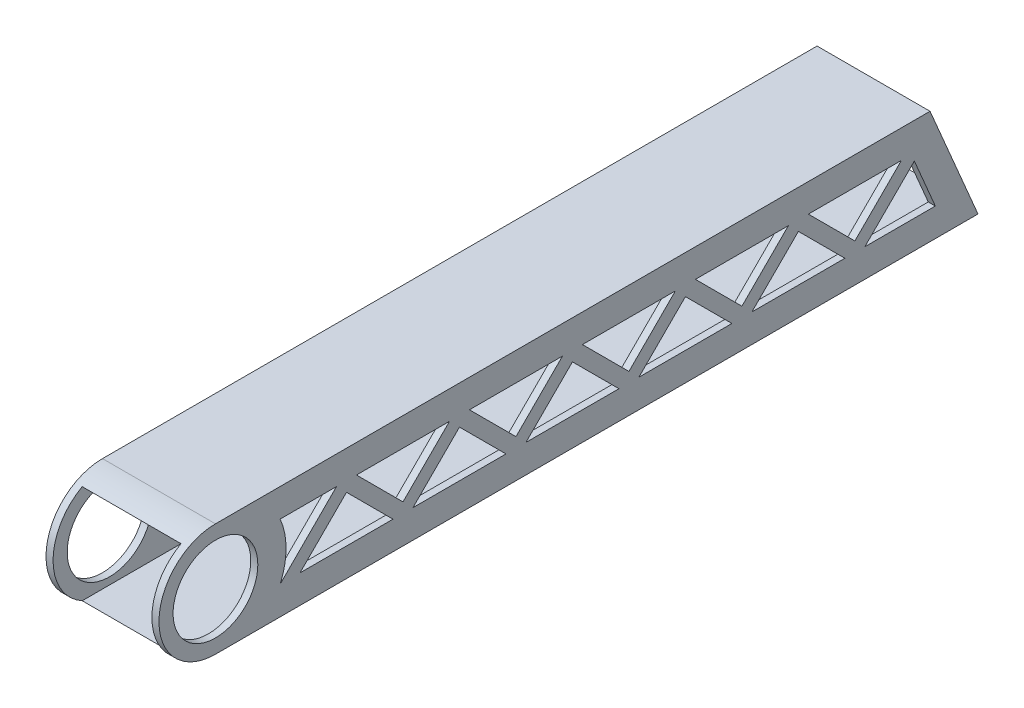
SolidWorks part; units mm, degrees
ref_plane "Front" through (0, 0, 0) normal (0, 0, 1) x (1, 0, 0)
ref_plane "Top" through (0, 0, 0) normal (0, 1, 0) x (1, 0, 0)
ref_plane "Right" through (0, 0, 0) normal (1, 0, 0) x (0, 0, -1)
sketch "Sketch2" plane through (0, 0, 0) normal (0, 0, 1) x (1, 0, 0)
  line L0 (3.175, 47.625) -> (47.625, 47.625)
  line L1 (0, 0) -> (50.8, 0)
  line L2 (0, 0) -> (0, 50.8)
  line L3 (0, 50.8) -> (50.8, 50.8)
  line L4 (50.8, 0) -> (50.8, 50.8)
  line L5 (47.625, 3.175) -> (47.625, 47.625)
  line L6 (3.175, 3.175) -> (47.625, 3.175)
  line L7 (3.175, 3.175) -> (3.175, 47.625)
  dimension "D1" = 50.8
  dimension "D2" = 50.8
  dimension "D3" = 3.175
extrude "Boss-Extrude2" add sketch "Sketch2" along normal blind 368.3
sketch "Sketch3" plane through (50.8, 0, 0) normal (1, 0, 0) x (0, 0, -1)
  line L0 (-368.3, 25.4) -> (0, 25.4) construction
  line L1 (-368.3, 0) -> (-368.3, 50.8) construction
  line L2 (0, 0) -> (0, 50.8) construction
  line L3 (-368.3, 50.8) -> (0, 50.8) construction
  arc A0 (-342.9, 50.8) -> (-342.9, 0) centre (-342.9, 25.4) ccw
extrude "Cut-Extrude1" cut sketch "Sketch3" against normal through all flip side to cut
sketch "Sketch4" plane through (50.8, 0, 0) normal (1, 0, 0) x (0, 0, -1)
  circle A0 centre (-342.9, 25.4) radius 19.05
  arc A1 (-342.9, 50.8) -> (-342.9, 0) centre (-342.9, 25.4) ccw construction
  dimension "D1" = 38.1
extrude "Cut-Extrude2" cut sketch "Sketch4" against normal blind 254
sketch "Sketch5" plane through (0, 0, 0) normal (-1, 0, 0) x (0, 0, 1)
  line L0 (0, 0) -> (21.5633, 50.8)
  line L3 (342.9, 50.8) -> (0, 50.8) construction
  line L4 (342.9, 0) -> (0, 0) construction
  dimension "D1" = 67
extrude "Cut-Extrude3" cut sketch "Sketch5" against normal through all and the other way through all
sketch "Sketch6" plane through (0, 0, 0) normal (-1, 0, 0) x (0, 0, 1)
  line L0 (29.9693, 38.1) -> (55.3693, 12.7) construction
  line L1 (55.3693, 12.7) -> (80.7693, 38.1) construction
  line L2 (80.7693, 38.1) -> (106.1693, 12.7) construction
  line L3 (131.5693, 38.1) -> (156.9693, 12.7) construction
  line L4 (182.3693, 38.1) -> (207.7693, 12.7) construction
  line L5 (233.1693, 38.1) -> (258.5693, 12.7) construction
  line L6 (283.9693, 38.1) -> (309.3693, 12.7) construction
  line L7 (182.3693, 38.1) -> (156.9693, 12.7) construction
  line L8 (207.7693, 12.7) -> (233.1693, 38.1) construction
  line L9 (258.5693, 12.7) -> (283.9693, 38.1) construction
  line L10 (131.5693, 38.1) -> (106.1693, 12.7) construction
  line L11 (28.6313, 34.9479) -> (50.8791, 12.7)
  line L12 (59.8594, 12.7) -> (80.7693, 33.6099)
  line L13 (80.7693, 33.6099) -> (101.6791, 12.7)
  line L14 (131.5693, 33.6099) -> (110.6594, 12.7)
  line L15 (131.5693, 33.6099) -> (152.4791, 12.7)
  line L16 (182.3693, 33.6099) -> (161.4594, 12.7)
  line L17 (182.3693, 33.6099) -> (203.2791, 12.7)
  line L18 (212.2594, 12.7) -> (233.1693, 33.6099)
  line L19 (233.1693, 33.6099) -> (254.0791, 12.7)
  line L20 (263.0594, 12.7) -> (283.9693, 33.6099)
  line L21 (342.9, 12.7) -> (19.1876, 12.7)
  line L22 (29.9693, 38.1) -> (342.9, 38.1)
  line L23 (19.1876, 12.7) -> (29.9693, 38.1)
  line L25 (34.4594, 38.1) -> (76.2791, 38.1)
  line L26 (19.1876, 12.7) -> (28.6313, 34.9479)
  line L27 (283.9693, 33.6099) -> (304.8791, 12.7)
  line L28 (34.4594, 38.1) -> (55.3693, 17.1901)
  line L29 (55.3693, 17.1901) -> (76.2791, 38.1)
  line L30 (85.2594, 38.1) -> (106.1693, 17.1901)
  line L31 (127.0791, 38.1) -> (106.1693, 17.1901)
  line L32 (136.0594, 38.1) -> (156.9693, 17.1901)
  line L33 (177.8791, 38.1) -> (156.9693, 17.1901)
  line L34 (186.8594, 38.1) -> (207.7693, 17.1901)
  line L35 (207.7693, 17.1901) -> (228.6791, 38.1)
  line L36 (237.6594, 38.1) -> (258.5693, 17.1901)
  line L37 (258.5693, 17.1901) -> (279.4791, 38.1)
  line L38 (288.4594, 38.1) -> (313.7555, 12.8039)
  line L39 (27.7242, 35.8549) -> (55.3693, 8.2099) construction
  line L40 (50.8791, 12.7) -> (19.1876, 12.7)
  line L41 (55.3693, 8.2099) -> (80.7693, 33.6099) construction
  line L42 (32.2143, 40.3451) -> (55.3693, 17.1901) construction
  line L43 (55.3693, 17.1901) -> (80.7693, 42.5901) construction
  line L44 (85.2594, 38.1) -> (127.0791, 38.1)
  line L45 (80.7693, 42.5901) -> (106.1693, 17.1901) construction
  line L46 (80.7693, 33.6099) -> (106.1693, 8.2099) construction
  line L47 (101.6791, 12.7) -> (59.8594, 12.7)
  line L48 (131.5693, 33.6099) -> (106.1693, 8.2099) construction
  line L49 (136.0594, 38.1) -> (177.8791, 38.1)
  line L50 (131.5693, 42.5901) -> (156.9693, 17.1901) construction
  line L51 (131.5693, 42.5901) -> (106.1693, 17.1901) construction
  line L52 (152.4791, 12.7) -> (110.6594, 12.7)
  line L53 (131.5693, 33.6099) -> (156.9693, 8.2099) construction
  line L54 (182.3693, 33.6099) -> (156.9693, 8.2099) construction
  line L55 (182.3693, 33.6099) -> (207.7693, 8.2099) construction
  line L56 (203.2791, 12.7) -> (161.4594, 12.7)
  line L57 (207.7693, 8.2099) -> (233.1693, 33.6099) construction
  line L58 (182.3693, 42.5901) -> (156.9693, 17.1901) construction
  line L59 (186.8594, 38.1) -> (228.6791, 38.1)
  line L60 (182.3693, 42.5901) -> (207.7693, 17.1901) construction
  line L61 (237.6594, 38.1) -> (279.4791, 38.1)
  line L62 (207.7693, 17.1901) -> (233.1693, 42.5901) construction
  line L63 (233.1693, 42.5901) -> (258.5693, 17.1901) construction
  line L64 (254.0791, 12.7) -> (212.2594, 12.7)
  line L65 (233.1693, 33.6099) -> (258.5693, 8.2099) construction
  line L66 (258.5693, 8.2099) -> (283.9693, 33.6099) construction
  line L67 (288.4594, 38.1) -> (313.8006, 38.1)
  line L68 (258.5693, 17.1901) -> (283.9693, 42.5901) construction
  line L69 (283.9693, 42.5901) -> (311.6143, 14.9451) construction
  line L70 (283.9693, 33.6099) -> (307.1242, 10.4549) construction
  line L71 (304.8791, 12.7) -> (263.0594, 12.7)
  circle A4 centre (342.9, 25.4) radius 31.75
  arc A5 (313.8006, 38.1) -> (313.7555, 12.8039) centre (342.9, 25.4) ccw
  point P3 (80.7693, 38.1)
  point P5 (106.1693, 12.7)
  point P10 (131.5693, 38.1)
  point P11 (156.9693, 12.7)
  point P12 (182.3693, 38.1)
  point P13 (207.7693, 12.7)
  point P14 (233.1693, 38.1)
  point P15 (258.5693, 12.7)
  point P16 (283.9693, 38.1)
  point P17 (309.3693, 12.7)
  point P19 (55.3693, 12.7)
  dimension "D3" = 50.8
  dimension "D4" = 50.8
  dimension "D5" = 50.8
  dimension "D6" = 50.8
  dimension "D7" = 50.8
  dimension "D8" = 25.4
  dimension "D9" = 50.8
  dimension "D10" = 50.8
  dimension "D11" = 50.8
  dimension "D12" = 50.8
  dimension "D13" = 50.8
  dimension "D1" = 12.7
  dimension "D2" = 12.7
  dimension "D14" = 3.175
  dimension "D15" = 3.175
extrude "Cut-Extrude4" cut sketch "Sketch6" against normal through all
fillet "Fillet2" radius 3.175 36 edges at (1.5875, 38.1, 288.4594) (1.5875, 38.1, 313.8006) (1.5875, 34.9479, 28.6313) (1.5875, 12.7, 19.1876) (1.5875, 12.7, 59.8594) (1.5875, 12.7, 101.6791) (1.5875, 33.6099, 80.7693) (1.5875, 12.7, 110.6594) (1.5875, 12.7, 152.4791) (1.5875, 33.6099, 131.5693) (1.5875, 12.7, 161.4594) (1.5875, 12.7, 203.2791) (1.5875, 33.6099, 182.3693) (1.5875, 12.7, 212.2594) (1.5875, 12.7, 254.0791) (1.5875, 33.6099, 233.1693) (1.5875, 38.1, 237.6594) (1.5875, 17.1901, 258.5693) (1.5875, 38.1, 279.4791) (1.5875, 38.1, 186.8594) (1.5875, 17.1901, 207.7693) (1.5875, 38.1, 228.6791) (1.5875, 38.1, 136.0594) (1.5875, 17.1901, 156.9693) (1.5875, 38.1, 177.8791) (1.5875, 38.1, 85.2594) (1.5875, 17.1901, 106.1693) (1.5875, 38.1, 127.0791) (1.5875, 38.1, 34.4594) (1.5875, 17.1901, 55.3693) (1.5875, 38.1, 76.2791) (1.5875, 12.7, 263.0594) (1.5875, 12.7, 304.8791) (1.5875, 33.6099, 283.9693) (1.5875, 12.7, 50.8791) (1.5875, 12.8039, 313.7555)
